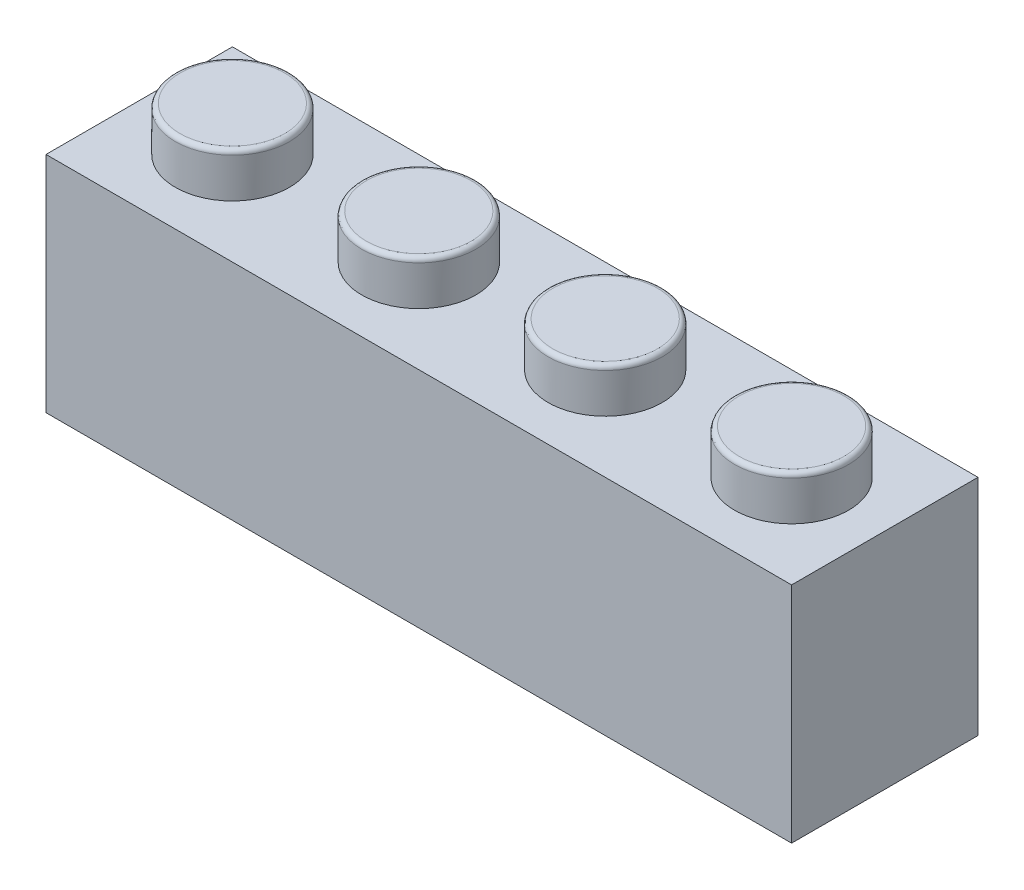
SolidWorks part; units mm, degrees
ref_plane "Vorne" through (0, 0, 0) normal (0, 0, 1) x (1, 0, 0)
ref_plane "Oben" through (0, 0, 0) normal (0, 1, 0) x (1, 0, 0)
ref_plane "Rechts" through (0, 0, 0) normal (1, 0, 0) x (0, 0, -1)
sketch "Skizze1" plane through (0, 0, 0) normal (0, 0, 1) x (1, 0, 0)
  line L1 (0, 0) -> (32, 0)
  line L2 (0, 0) -> (0, 9.6)
  line L3 (0, 9.6) -> (32, 9.6)
  line L4 (32, 0) -> (32, 9.6)
  dimension "D1" = 9.6
  dimension "D2" = 32
extrude "Linear austragen1" add sketch "Skizze1" along normal blind 8
sketch "Skizze2" plane through (0, 9.6, 0) normal (0, 1, 0) x (-1, 0, 0)
  line L0 (0, 8) -> (0, 0) construction
  line L1 (-32, 0) -> (0, 0) construction
  circle A0 centre (-4, 4) radius 2.45
  dimension "D3" = 4.9
  dimension "D1" = 4
  dimension "D2" = 4
extrude "Linear austragen2" add sketch "Skizze2" along normal blind 1.9
fillet "Verrundung1" radius 0.2 1 edges at (4, 11.5, 6.45)
sketch "Skizze3" plane through (0, 0, 0) normal (0, -1, 0) x (1, 0, 0)
  line L0 (0, 8) -> (32, 8) construction
  line L1 (1.6, 6.4) -> (30.4, 6.4)
  line L2 (1.6, 6.4) -> (1.6, 1.6)
  line L3 (1.6, 1.6) -> (30.4, 1.6)
  line L4 (30.4, 6.4) -> (30.4, 1.6)
  line L5 (0, 0) -> (32, 0) construction
  line L6 (32, 8) -> (32, 0) construction
  line L7 (0, 8) -> (0, 0) construction
  dimension "D1" = 1.6
  dimension "D2" = 1.6
  dimension "D3" = 1.6
  dimension "D4" = 1.6
extrude "Schnitt-Linear austragen1" cut sketch "Skizze3" against normal blind 8.5
sketch "Skizze4" plane through (0, 8.5, 0) normal (0, -1, 0) x (1, 0, 0)
  circle A0 centre (4, 4) radius 1.6
extrude "Schnitt-Linear austragen2" cut sketch "Skizze4" against normal blind 1.8
pattern_linear "Lineares Muster2" count 4 spacing 8 along (1, 0, 0) of "Linear austragen2", "Verrundung1", "Schnitt-Linear austragen2"
sketch "Skizze5" plane through (0, 8.5, 0) normal (0, -1, 0) x (1, 0, 0)
  line L0 (1.6, 6.4) -> (1.6, 1.6) construction
  line L2 (0, 0) -> (32, 0) construction
  circle A2 centre (8, 4) radius 1.6
  dimension "D1" = 3.2
  dimension "D2" = 6.4
  dimension "D3" = 4
extrude "Linear austragen3" add sketch "Skizze5" along normal blind 8.4
pattern_linear "Lineares Muster4" count 3 spacing 8 along (1, 0, 0) of "Linear austragen3"
